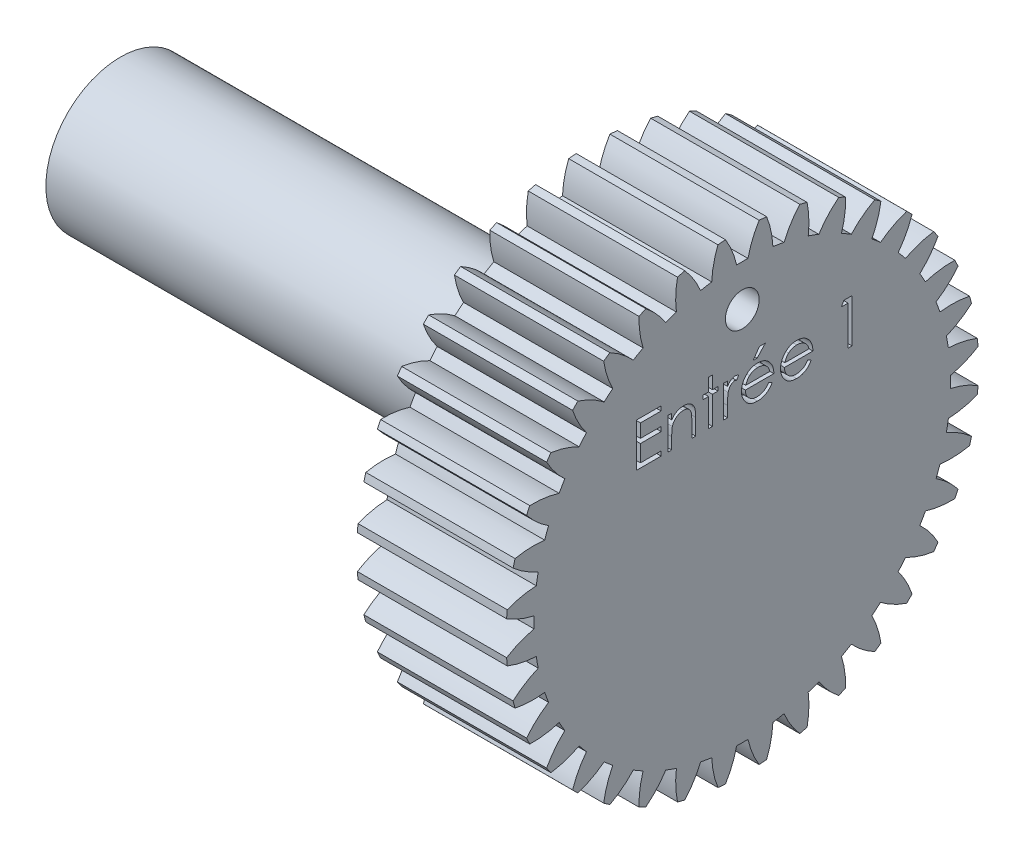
SolidWorks part; units mm, degrees
other "<Spur Gear_AM>-<Bore>"
ref_plane "Face" through (0, 0, 0) normal (0, 0, 1) x (1, 0, 0)
ref_plane "Dessus" through (0, 0, 0) normal (0, 1, 0) x (1, 0, 0)
ref_plane "Droite" through (0, 0, 0) normal (1, 0, 0) x (0, 0, -1)
inserted part "Spur Gear_AM"
sketch "Esquisse1" plane through (12, 0, 0) normal (1, 0, 0) x (0, 0, -1)
  circle A0 centre (0, 0) radius 6
extrude "Extrusion1" add sketch "Esquisse1" against normal blind 50
sketch "Esquisse2" plane through (12, 0, 0) normal (1, 0, 0) x (0, 0, -1)
  circle A0 centre (0, 13.4279) radius 1.3584
extrude "Enlèv. mat.-Extru.1" cut sketch "Esquisse2" against normal through all
sketch "Esquisse3" plane through (12, 0, 0) normal (1, 0, 0) x (0, 0, -1)
  circle A0 centre (0, 0) radius 18
sketch "Esquisse4" plane through (12, 0, 0) normal (1, 0, 0) x (0, 0, -1)
  text T0 "Entrée 1"
extrude "Enlèv. mat.-Extru.2" cut sketch "Esquisse4" against normal blind 1
